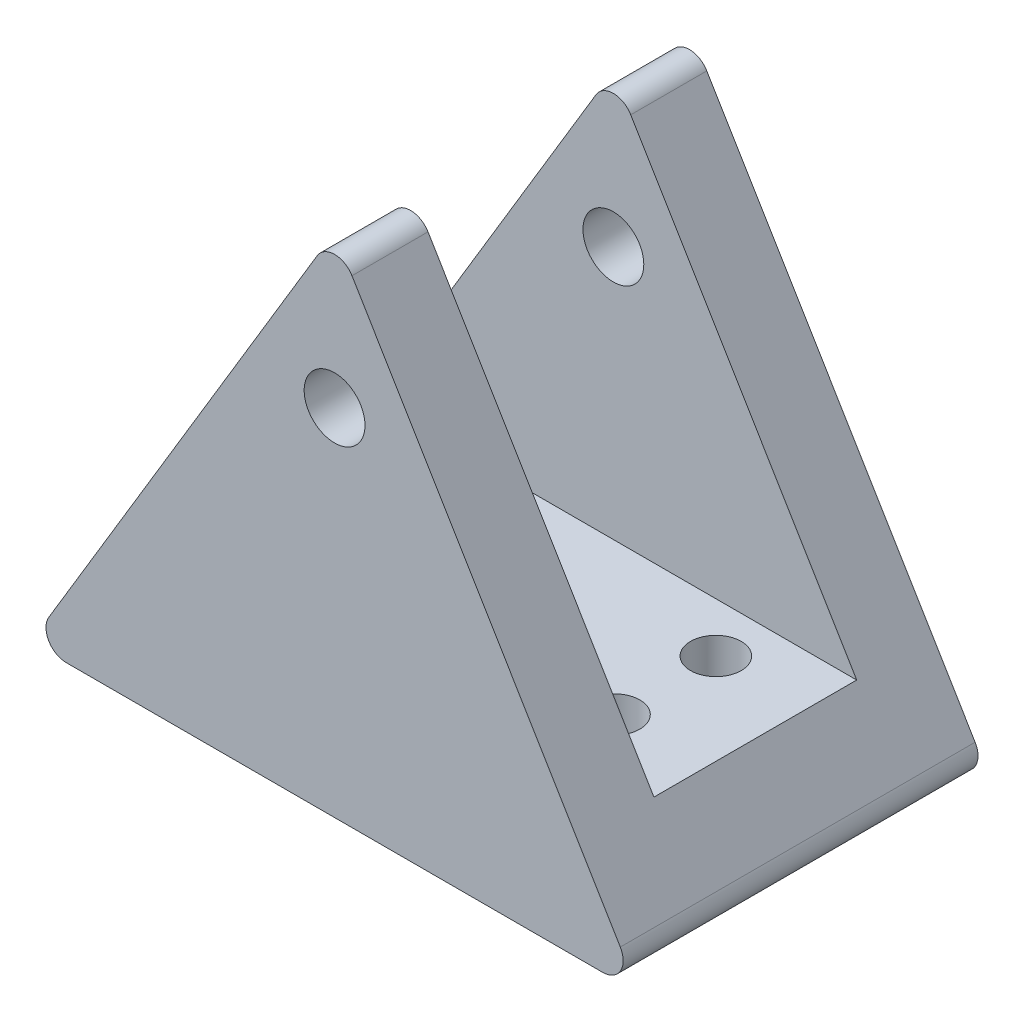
SolidWorks part; units mm, degrees
ref_plane "Front Plane" through (0, 0, 0) normal (0, 0, 1) x (1, 0, 0)
ref_plane "Top Plane" through (0, 0, 0) normal (0, 1, 0) x (1, 0, 0)
ref_plane "Right Plane" through (0, 0, 0) normal (1, 0, 0) x (0, 0, -1)
sketch "Sketch2" plane through (0, 0, 0) normal (0, 0, 1) x (1, 0, 0)
  line L1 (-38.1, 31.75) -> (38.1, 31.75)
  line L2 (-38.1, 31.75) -> (-38.1, -31.75)
  line L3 (-38.1, -31.75) -> (38.1, -31.75)
  line L4 (38.1, 31.75) -> (38.1, -31.75)
  line L5 (-38.1, 31.75) -> (38.1, -31.75) construction
  line L6 (-38.1, -31.75) -> (38.1, 31.75) construction
  point P0 (0, 0)
  dimension "D1" = 76.2
  dimension "D2" = 63.5
extrude "Boss-Extrude1" add sketch "Sketch2" along normal blind 44.45
sketch "Sketch3" plane through (0, 0, 44.45) normal (0, 0, 1) x (1, 0, 0)
  line L0 (0, 31.75) -> (0, -31.75) construction
  line L1 (-38.1, -31.75) -> (38.1, -31.75) construction
  line L2 (-38.1, -31.75) -> (0, 31.75)
  line L4 (-38.1, 31.75) -> (-38.1, -31.75)
  line L7 (-38.1, 31.75) -> (0, 31.75)
  point P6 (0, 0)
sketch "Sketch5" plane through (38.1, 0, 0) normal (1, 0, 0) x (0, 0, -1)
  line L0 (0, 0) -> (-44.45, 0) construction
  line L1 (-44.45, 0) -> (-22.225, 31.75) construction
  line L2 (-44.45, 31.75) -> (0, 31.75) construction
  line L3 (-22.225, 31.75) -> (-22.225, -31.75) construction
  line L4 (-44.45, -31.75) -> (0, -31.75) construction
  line L5 (-34.925, -19.05) -> (-9.525, -19.05)
  line L6 (-34.925, -19.05) -> (-34.925, 31.75)
  line L7 (-34.925, 31.75) -> (-9.525, 31.75)
  line L8 (-9.525, 31.75) -> (-9.525, -19.05)
  point P13 (-22.225, -19.05)
  dimension "D1" = 25.4
  dimension "D2" = 50.8
extrude "Cut-Extrude3" cut sketch "Sketch5" against normal through all
extrude "Cut-Extrude4" cut sketch "Sketch3" against normal blind 44.45
sketch "Sketch6" plane through (0, 0, 44.45) normal (0, 0, 1) x (1, 0, 0)
  line L0 (0, 31.75) -> (38.1, -31.75)
  line L1 (38.1, -31.75) -> (38.1, 31.75)
  line L2 (38.1, 31.75) -> (0, 31.75)
extrude "Cut-Extrude5" cut sketch "Sketch6" against normal through all
sketch "Sketch7" plane through (0, -19.05, 0) normal (0, 1, 0) x (1, 0, 0)
  line L0 (0, 0) -> (0, -44.1741) construction
  line L1 (-30.48, -22.087) -> (30.48, -22.087) construction
  line L2 (30.48, -34.925) -> (30.48, -9.525) construction
  line L4 (-38.1, -44.45) -> (-38.1, 0) construction
  circle A0 centre (-19.05, -15.737) radius 3.175
  circle A1 centre (19.05, -15.737) radius 3.175
  circle A2 centre (19.05, -28.437) radius 3.175
  circle A3 centre (-19.05, -28.437) radius 3.175
  point P9 (0, -22.087)
  dimension "D1" = 6.35
  dimension "D2" = 6.35
  dimension "D3" = 19.05
extrude "Cut-Extrude6" cut sketch "Sketch7" against normal blind 44.45
sketch "Sketch8" plane through (0, 0, 44.45) normal (0, 0, 1) x (1, 0, 0)
  line L0 (0, 31.75) -> (0, 8.89) construction
  circle A0 centre (0, 12.7) radius 3.81
  point P6 (0, 0)
  dimension "D1" = 7.62
  dimension "D2" = 19.05
extrude "Cut-Extrude7" cut sketch "Sketch8" against normal through all
fillet "Fillet3" radius 2.54 4 edges at (38.1, -31.75, 22.225) (0, 31.75, 39.6875) (0, 31.75, 4.7625) (-38.1, -31.75, 22.225)
